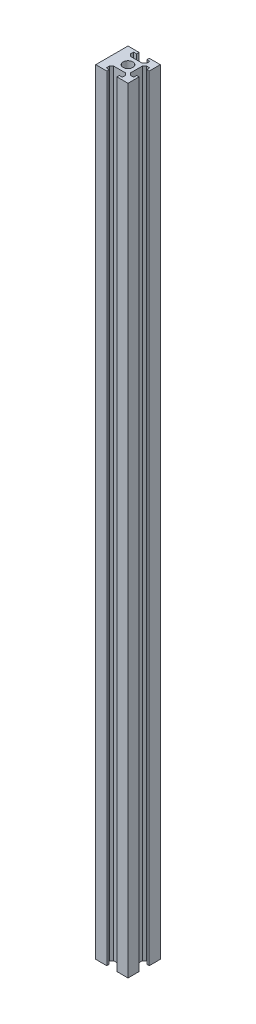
SolidWorks part; units mm, degrees
ref_plane "Ebene vorne" through (0, 0, 0) normal (0, 0, 1) x (1, 0, 0)
ref_plane "Ebene oben" through (0, 0, 0) normal (0, 1, 0) x (1, 0, 0)
ref_plane "Ebene rechts" through (0, 0, 0) normal (1, 0, 0) x (0, 0, -1)
sketch "Skizze1" plane through (0, 0, 0) normal (0, 1, 0) x (1, 0, 0)
  line L0 (0, 54.0679) -> (0, -54.0679) construction
  line L1 (-53.0666, 0) -> (53.0666, 0) construction
  line L2 (-3.125, 10) -> (-3.125, 8.5)
  line L3 (-10, 10) -> (-3.125, 10)
  line L4 (-10, 10) -> (-10, -10)
  line L5 (-10, -10) -> (-3.125, -10)
  line L6 (10, 10) -> (10, 3.125)
  line L7 (-3.125, 8.5) -> (-5, 8.5)
  line L8 (-5, 8.5) -> (-5, 6.5048)
  line L9 (-5, 6.5048) -> (-3.7072, 5.2)
  line L10 (-3.7072, 5.2) -> (3.7072, 5.2)
  line L11 (5, 6.5048) -> (3.7072, 5.2)
  line L12 (5, 8.5) -> (5, 6.5048)
  line L13 (3.125, 8.5) -> (5, 8.5)
  line L14 (3.125, 10) -> (3.125, 8.5)
  line L15 (10, 3.125) -> (8.5, 3.125)
  line L16 (8.5, 3.125) -> (8.5, 5)
  line L17 (8.5, 5) -> (6.5048, 5)
  line L18 (6.5048, 5) -> (5.2, 3.7072)
  line L19 (5.2, 3.7072) -> (5.2, -3.7072)
  line L20 (6.5048, -5) -> (5.2, -3.7072)
  line L21 (8.5, -5) -> (6.5048, -5)
  line L22 (8.5, -3.125) -> (8.5, -5)
  line L23 (10, -3.125) -> (8.5, -3.125)
  line L24 (54.0679, 0) -> (-54.0679, 0) construction
  line L25 (3.125, -10) -> (3.125, -8.5)
  line L26 (3.125, -8.5) -> (5, -8.5)
  line L27 (5, -8.5) -> (5, -6.5048)
  line L28 (5, -6.5048) -> (3.7072, -5.2)
  line L29 (3.7072, -5.2) -> (-3.7072, -5.2)
  line L30 (-5, -6.5048) -> (-3.7072, -5.2)
  line L31 (-5, -8.5) -> (-5, -6.5048)
  line L32 (-3.125, -8.5) -> (-5, -8.5)
  line L33 (-3.125, -10) -> (-3.125, -8.5)
  line L34 (0, -54.0679) -> (0, 54.0679) construction
  line L35 (3.125, 10) -> (10, 10)
  line L36 (10, -3.125) -> (10, -10)
  line L37 (3.125, -10) -> (10, -10)
  circle A0 centre (0, 0) radius 3
  point P0 (0, 0)
  point P19 (0, 5.2)
  point P34 (5.2, 0)
  point P47 (0, -5.2)
  point P51 (0, 0)
  dimension "D3" = 6
  dimension "D1" = 20
  dimension "D2" = 20
  dimension "D4" = 1.5
  dimension "D5" = 10
  dimension "D6" = 6.25
  dimension "D7" = 4.8
  dimension "D8" = 3
extrude "Aufsatz-Linear austragen1" add sketch "Skizze1" along normal blind 480
